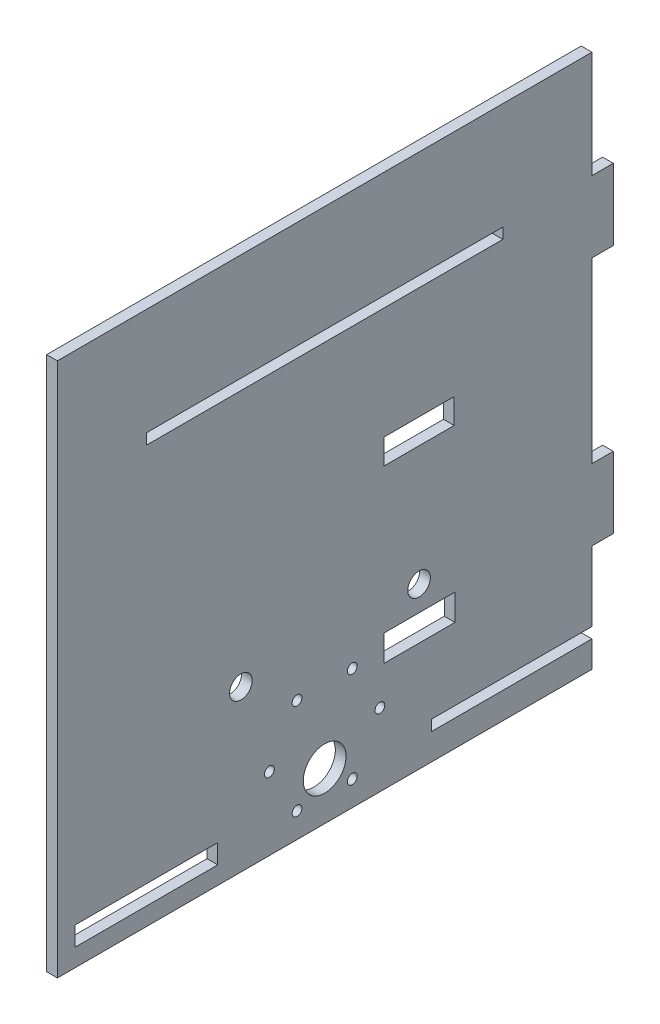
SolidWorks part; units mm, degrees
ref_plane "Front Plane" through (0, 0, 0) normal (0, 0, 1) x (1, 0, 0)
ref_plane "Top Plane" through (0, 0, 0) normal (0, 1, 0) x (1, 0, 0)
ref_plane "Right Plane" through (0, 0, 0) normal (1, 0, 0) x (0, 0, -1)
sketch "Sketch1" plane through (0, 0, 0) normal (1, 0, 0) x (0, 0, -1)
  line L1 (-75, 75) -> (75, 75)
  line L2 (-75, 75) -> (-75, -75)
  line L3 (-75, -75) -> (75, -75)
  line L4 (75, 75) -> (75, -75)
  line L5 (-75, 75) -> (75, -75) construction
  line L6 (-75, -75) -> (75, 75) construction
  point P0 (0, 0)
  dimension "D1" = 150
  dimension "D2" = 150
extrude "Boss-Extrude1" add sketch "Sketch1" along normal blind 3
sketch "Sketch2" plane through (3, 0, 0) normal (1, 0, 0) x (0, 0, -1)
  line L0 (75, -75) -> (75, 75) construction
  line L1 (75, 45) -> (81, 45)
  line L2 (75, 45) -> (75, 25)
  line L3 (75, 25) -> (81, 25)
  line L4 (81, 45) -> (81, 25)
  line L5 (75, 75) -> (-75, 75) construction
  line L6 (0, 0) -> (75, 0) construction
  line L7 (81, -45) -> (81, -25)
  line L8 (75, -25) -> (81, -25)
  line L9 (75, -45) -> (75, -25)
  line L10 (75, -45) -> (81, -45)
  dimension "D1" = 6
  dimension "D2" = 20
  dimension "D3" = 30
extrude "mount to back" add sketch "Sketch2" against normal blind 3
sketch "Sketch4" plane through (0, 0, 0) normal (-1, 0, 0) x (0, 0, 1)
  line L0 (75, -75) -> (-75, -75) construction
  line L1 (0, -19.333) -> (0, -93.5545) construction
  line L2 (-75, 82.405) -> (-75, -67.595) construction
  line L3 (30, -64.595) -> (70, -64.595) construction
  line L4 (70, -64.595) -> (30, -64.595)
  line L5 (70, -64.595) -> (70, -70)
  line L6 (70, -70) -> (30, -70)
  line L7 (-50, 44.9999) -> (50, 44.9999)
  line L8 (-75, -75) -> (-75, -45) construction
  line L9 (-30, -67.595) -> (-75, -67.595)
  line L10 (-30, -67.595) -> (-30, -64.595)
  line L11 (-30, -64.595) -> (-75, -64.595)
  line L12 (-75, -67.595) -> (-75, -64.595)
  line L13 (-75, -64.595) -> (-30, -64.595) construction
  line L14 (-50, 44.9999) -> (-50, 41.9999)
  line L15 (30, -64.595) -> (30, -70)
  line L16 (75, 75) -> (75, -75) construction
  line L17 (-50, 41.9999) -> (50, 41.9999)
  line L18 (50, 44.9999) -> (50, 41.9999)
  line L19 (-50, 44.9999) -> (50, 44.9999) construction
  circle A0 centre (-26.5, -30) radius 3.175
  circle A1 centre (23.5, -30) radius 3.175
  circle A2 centre (7.75, -41.1716) radius 1.3727
  circle A3 centre (15.5, -54.595) radius 1.3727
  circle A4 centre (7.75, -68.0184) radius 1.3727
  circle A5 centre (-7.75, -68.0184) radius 1.3727
  circle A6 centre (-15.5, -54.595) radius 1.3727
  circle A7 centre (-7.75, -41.1716) radius 1.3727
  circle A8 centre (0, -61.595) radius 6
extrude "motor linkage bottom cut" cut sketch "Sketch4" against normal through all
sketch "Sketch6" plane through (3, 0, 0) normal (1, 0, 0) x (0, 0, -1)
  line L1 (36.5711, -44.3607) -> (16.6575, -44.3607)
  line L2 (36.5711, -44.3607) -> (36.5711, -36.9953)
  line L3 (36.5711, -36.9953) -> (16.6575, -36.9953)
  line L4 (16.6575, -44.3607) -> (16.6575, -36.9953)
extrude "servobottomslot" cut sketch "Sketch6" against normal blind 10
sketch "Sketch7" plane through (3, 0, 0) normal (1, 0, 0) x (0, 0, -1)
  line L1 (36.3425, 3.6053) -> (16.6575, 3.6053)
  line L2 (36.3425, 3.6053) -> (36.3425, 10.6255)
  line L3 (36.3425, 10.6255) -> (16.6575, 10.6255)
  line L4 (16.6575, 3.6053) -> (16.6575, 10.6255)
extrude "servotopslot" cut sketch "Sketch7" against normal blind 10
equation "\"sheet thickness\"= 3mm"
equation "\"D1@Boss-Extrude1\"=\"sheet thickness\""
equation "\"D1@mount to back\" = \"sheet thickness\""
equation "\"shaft size\"= .25in"
equation "\"D1@Sketch4\"=\"shaft size\""
